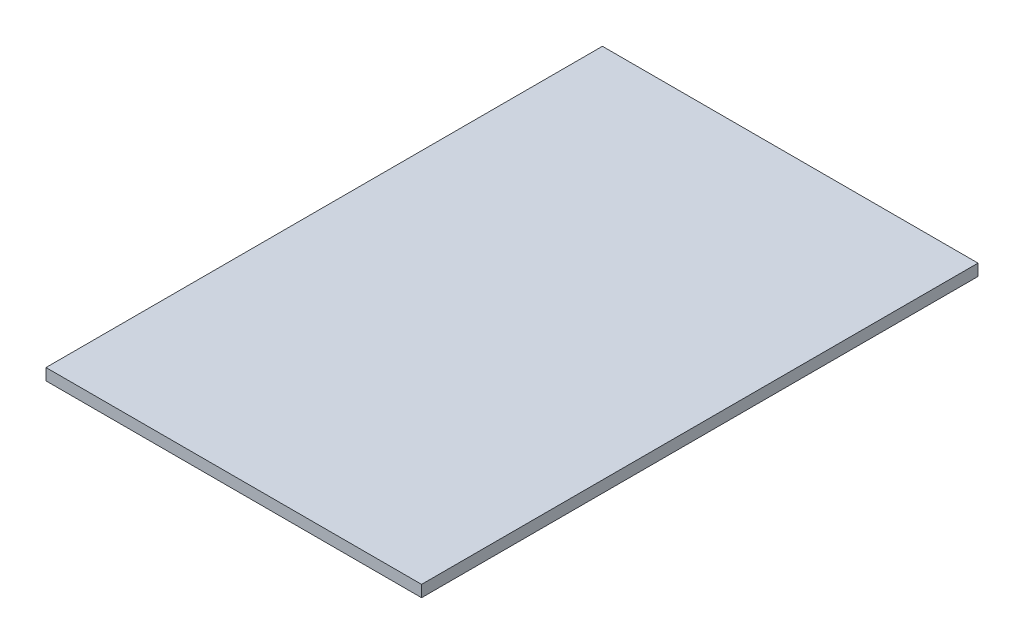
SolidWorks part; units mm, degrees
ref_plane "Front Plane" through (0, 0, 0) normal (0, 0, 1) x (1, 0, 0)
ref_plane "Top Plane" through (0, 0, 0) normal (0, 1, 0) x (1, 0, 0)
ref_plane "Right Plane" through (0, 0, 0) normal (1, 0, 0) x (0, 0, -1)
sketch "Sketch2" plane through (0, 0, 0) normal (0, 1, 0) x (1, 0, 0)
  line L1 (-66.5067, 60) -> (14.4933, 60)
  line L2 (-66.5067, 60) -> (-66.5067, -60)
  line L3 (-66.5067, -60) -> (14.4933, -60)
  line L4 (14.4933, 60) -> (14.4933, -60)
  line L5 (-66.5067, 60) -> (14.4933, -60) construction
  line L6 (-66.5067, -60) -> (14.4933, 60) construction
  point P0 (-26.0067, 0)
  dimension "D1" = 120
  dimension "D2" = 81
extrude "Boss-Extrude1" add sketch "Sketch2" along normal blind 2.5
